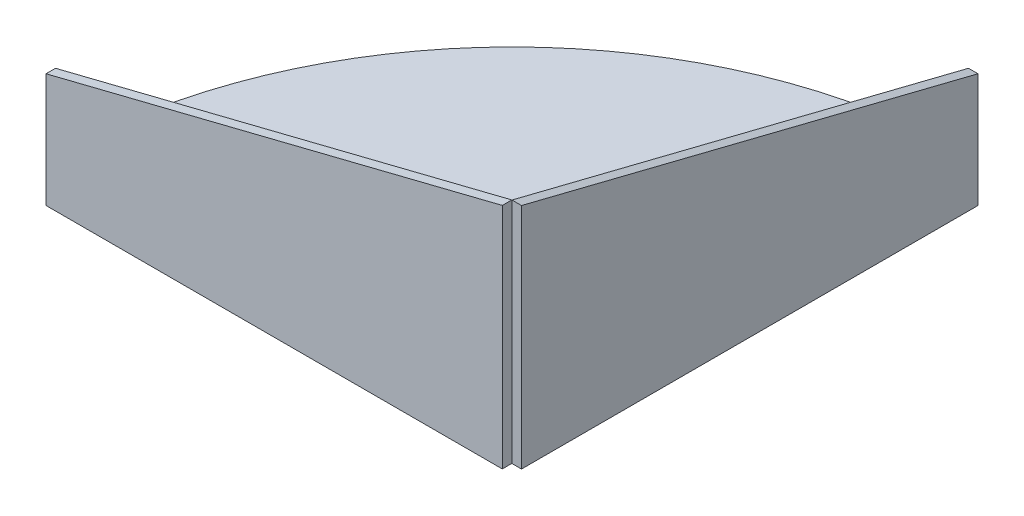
SolidWorks part; units mm, degrees
ref_plane "Front Plane" through (0, 0, 0) normal (0, 0, 1) x (1, 0, 0)
ref_plane "Top Plane" through (0, 0, 0) normal (0, 1, 0) x (1, 0, 0)
ref_plane "Right Plane" through (0, 0, 0) normal (1, 0, 0) x (0, 0, -1)
sketch "Sketch1" plane through (0, 0, 0) normal (0, 1, 0) x (1, 0, 0)
  line L0 (-304.8, -304.8) -> (304.8, 304.8) construction
  line L3 (-304.8, -304.8) -> (304.8, -304.8)
  line L4 (304.8, 304.8) -> (304.8, -304.8)
  arc A0 (-304.8, -304.8) -> (304.8, 304.8) centre (304.8, -304.8) cw
  point P4 (0, 0)
  dimension "D1" = 609.6
extrude "Extrude1" add sketch "Sketch1" along normal blind 12.7
sketch "Sketch2" plane through (304.8, 0, 0) normal (1, 0, 0) x (0, 0, -1)
  line L0 (-304.8, 12.7) -> (-304.8, 266.7)
  line L1 (-304.8, 266.7) -> (304.8, 114.3)
  line L2 (304.8, 114.3) -> (304.8, 12.7)
  line L4 (-304.8, 12.7) -> (-304.8, -38.1)
  line L5 (-304.8, -38.1) -> (304.8, -38.1)
  line L6 (304.8, -38.1) -> (304.8, 12.7)
  dimension "D1" = 101.6
  dimension "D2" = 254
  dimension "D3" = 50.8
extrude "Extrude2" add sketch "Sketch2" along normal blind 12.7
sketch "Sketch3" plane through (0, 0, 304.8) normal (0, 0, 1) x (1, 0, 0)
  line L2 (304.546, 266.7) -> (304.546, -38.1)
  line L3 (304.8, 266.7) -> (304.8, 12.7) construction
  line L4 (-304.8, 12.7) -> (304.8, 12.7) construction
  line L8 (-304.8, 0) -> (304.8, 0) construction
  line L9 (304.546, 266.7) -> (-304.8, 114.3)
  line L10 (-304.8, 114.3) -> (-304.8, -38.1)
  line L11 (-304.8, -38.1) -> (304.546, -38.1)
  line L12 (-304.8, 12.7) -> (-304.8, 0) construction
  dimension "D1" = 0.254
  dimension "D2" = 254
  dimension "D3" = 38.1
  dimension "D4" = 101.6
extrude "Extrude3" add sketch "Sketch3" along normal blind 12.7
